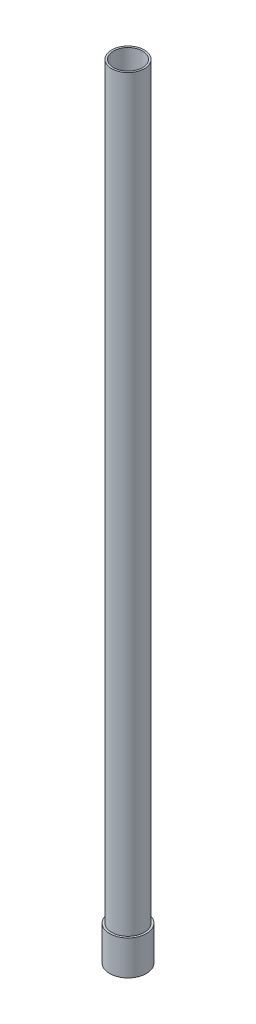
SolidWorks part; units mm, degrees
ref_plane "Front Plane" through (0, 0, 0) normal (0, 0, 1) x (1, 0, 0)
ref_plane "Top Plane" through (0, 0, 0) normal (0, 1, 0) x (1, 0, 0)
ref_plane "Right Plane" through (0, 0, 0) normal (1, 0, 0) x (0, 0, -1)
sketch "Sketch2" plane through (0, 0, 0) normal (0, 0, 1) x (1, 0, 0)
  line L0 (0, 0) -> (0, 304.8) construction
  line L1 (-5.6388, 0) -> (-7.1437, 0)
  line L2 (-7.1437, 0) -> (-7.1437, 13.4874)
  line L3 (-7.1437, 13.4874) -> (-6.35, 13.4874)
  line L4 (-6.35, 13.4874) -> (-6.35, 304.8)
  line L5 (-6.35, 304.8) -> (-5.6388, 304.8)
  line L6 (-5.6388, 0) -> (-5.6388, 304.8)
  dimension "D1" = 13.4874
  dimension "D2" = 14.2875
  dimension "D3" = 12.7
  dimension "D4" = 304.8
  dimension "D5" = 11.2776
revolve "Revolve1" add sketch "Sketch2" angle 360 about L0
